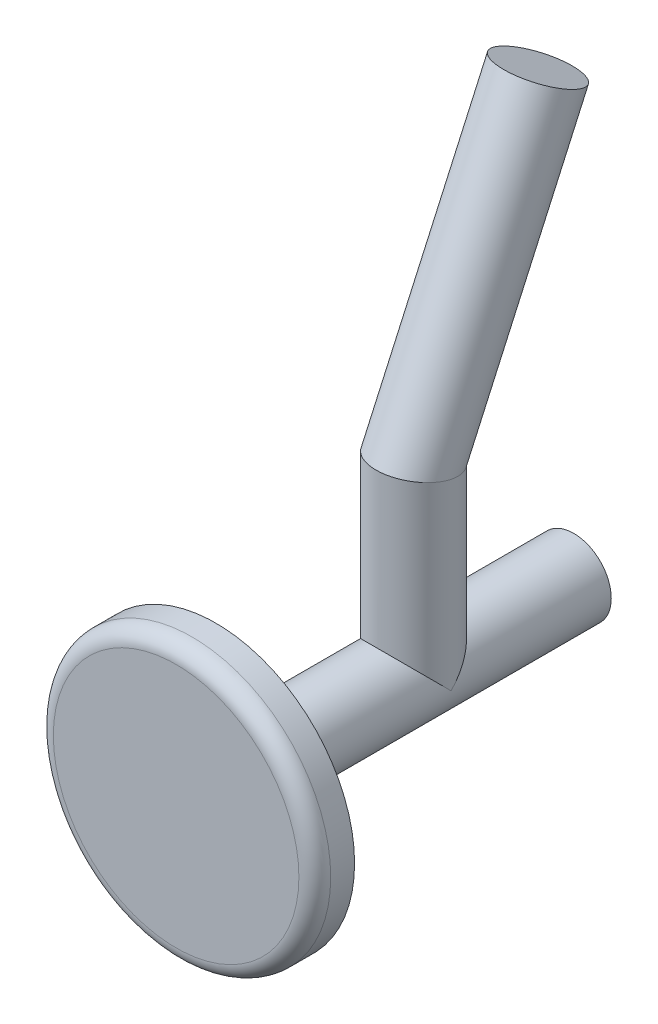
SolidWorks part; units mm, degrees
ref_plane "Plan de face" through (0, 0, 0) normal (0, 0, 1) x (1, 0, 0)
ref_plane "Plan de dessus" through (0, 0, 0) normal (0, 1, 0) x (1, 0, 0)
ref_plane "Plan de droite" through (0, 0, 0) normal (1, 0, 0) x (0, 0, -1)
sketch "Esquisse1" plane through (0, 0, 0) normal (0, 0, 1) x (1, 0, 0)
  circle A0 centre (0, 0) radius 40
  dimension "D1" = 80
extrude "Boss.-Extru.1" add sketch "Esquisse1" along normal blind 150
fillet "Congé1" radius 5 1 edges at (40, 0, 0)
sketch "Esquisse2" plane through (0, 0, 150) normal (0, 0, 1) x (1, 0, 0)
  circle A1 centre (0, 0) radius 40
  circle A2 centre (0, 0) radius 40
  dimension "D1" = 0
extrude "Boss.-Extru.2" add sketch "Esquisse2" along normal blind 50 draft 24
sketch "Esquisse3" plane through (0, 0, 200) normal (0, 0, 1) x (1, 0, 0)
  circle A0 centre (0, 0) radius 4.716
extrude "Boss.-Extru.3" add sketch "Esquisse3" along normal blind 50
sketch "Esquisse4" plane through (0, 0, 250) normal (0, 0, 1) x (1, 0, 0)
  circle A0 centre (0, 0) radius 17.44
extrude "Boss.-Extru.4" add sketch "Esquisse4" against normal blind 5
fillet "Congé2" radius 2 1 edges at (17.44, 0, 250)
sketch "Esquisse5" plane through (0, 0, 0) normal (0, 1, 0) x (1, 0, 0)
  circle A0 centre (0, -220.1474) radius 4.716
sketch "Esquisse6" plane through (0, 0, 0) normal (1, 0, 0) x (0, 0, -1)
  line L0 (-220.1474, 0) -> (-220.1474, 23.0189)
  line L1 (-215.4314, 0) -> (-224.8633, 0) construction
  line L2 (-220.1474, 23.0189) -> (-204.4987, 57.6695)
sweep "Balayage1" add profiles "Esquisse5" path "Esquisse6"
sketch "Esquisse7" plane through (0, 0, 200) normal (0, 0, 1) x (1, 0, 0)
  circle A0 centre (0, 0) radius 147.3281
extrude "Enlèv. mat.-Extru.1" cut sketch "Esquisse7" against normal through all
